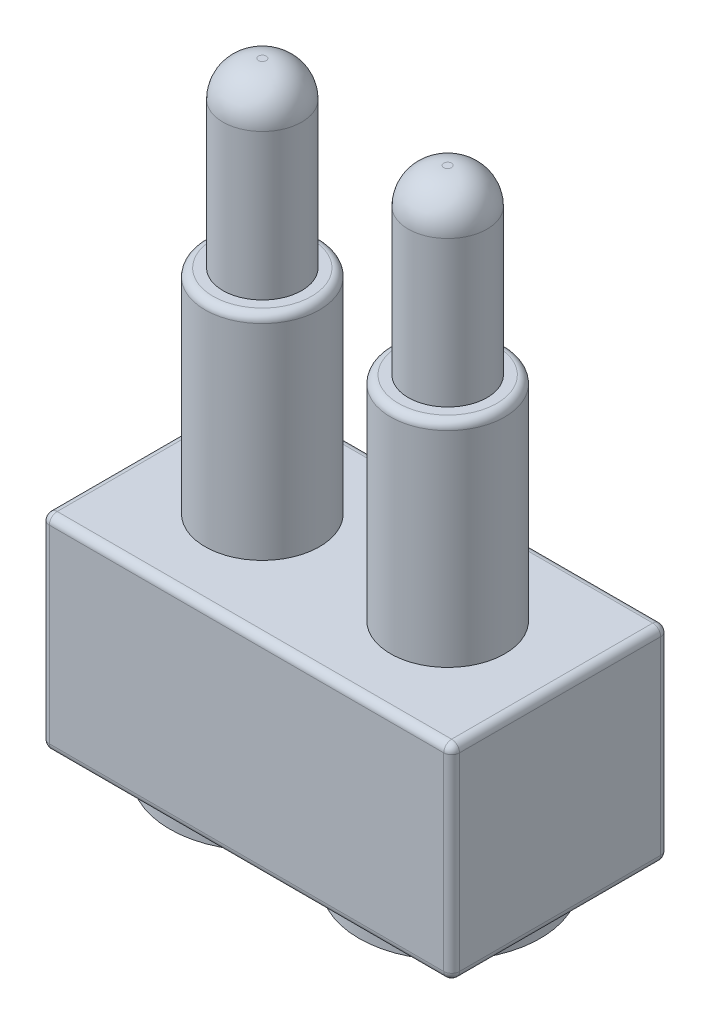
SolidWorks part; units mm, degrees
ref_plane "Спереди" through (0, 0, 0) normal (0, 0, 1) x (1, 0, 0)
ref_plane "Сверху" through (0, 0, 0) normal (0, 1, 0) x (1, 0, 0)
ref_plane "Справа" through (0, 0, 0) normal (1, 0, 0) x (0, 0, -1)
sketch "Эскиз1" plane through (0, 0, 0) normal (0, 1, 0) x (1, 0, 0)
  line L1 (-2.6, 1.375) -> (2.6, 1.375)
  line L2 (-2.6, 1.375) -> (-2.6, -1.375)
  line L3 (-2.6, -1.375) -> (2.6, -1.375)
  line L4 (2.6, 1.375) -> (2.6, -1.375)
  line L5 (-2.6, 1.375) -> (2.6, -1.375) construction
  line L6 (-2.6, -1.375) -> (2.6, 1.375) construction
  point P0 (0, 0)
  dimension "D1" = 2.75
  dimension "D2" = 5.2
extrude "Бобышка-Вытянуть1" add sketch "Эскиз1" along normal blind 2.6
sketch "Эскиз2" plane through (0, 0, 0) normal (0, -1, 0) x (1, 0, 0)
  line L0 (0, 1.375) -> (0, -1.375) construction
  line L1 (-2.6, 1.375) -> (2.6, 1.375) construction
  line L2 (2.6, -1.375) -> (-2.6, -1.375) construction
  line L3 (-2.6, 0) -> (2.6, 0) construction
  line L4 (-2.6, -1.375) -> (-2.6, 1.375) construction
  line L5 (2.6, 1.375) -> (2.6, -1.375) construction
  circle A0 centre (-1.2, 0) radius 1.15
  circle A1 centre (1.2, 0) radius 1.15
  point P14 (-1.1784, 0.2484)
  point P15 (0, 0)
  point P16 (-1.2995, 0)
  dimension "D1" = 2.3
  dimension "D2" = 4.7
extrude "Бобышка-Вытянуть2" add sketch "Эскиз2" along normal blind 0.3
sketch "Эскиз3" plane through (0, 2.6, 0) normal (0, 1, 0) x (1, 0, 0)
  line L0 (-2.6, 0) -> (2.6, 0) construction
  line L1 (-2.6, 1.375) -> (-2.6, -1.375) construction
  line L2 (2.6, -1.375) -> (2.6, 1.375) construction
  line L3 (0, 1.375) -> (0, 0) construction
  line L4 (2.6, 1.375) -> (-2.6, 1.375) construction
  circle A0 centre (-1.175, 0) radius 0.725
  circle A1 centre (1.175, 0) radius 0.725
  dimension "D1" = 1.45
  dimension "D2" = 3.8
extrude "Бобышка-Вытянуть3" add sketch "Эскиз3" along normal blind 2.7
sketch "Эскиз4" plane through (0, 5.3, 0) normal (0, 1, 0) x (1, 0, 0)
  circle A0 centre (-1.175, 0) radius 0.5
  circle A1 centre (1.175, 0) radius 0.5
  dimension "D1" = 1
extrude "Бобышка-Вытянуть4" add sketch "Эскиз4" along normal blind 2.3
fillet "Скругление1" radius 0.45 2 edges at (-1.175, 7.6, 0.5) (1.175, 7.6, 0.5)
fillet "Скругление2" radius 0.1 2 edges at (-1.175, 5.3, 0.725) (1.175, 5.3, -0.725)
fillet "Скругление3" radius 0.1 12 edges at (-2.6, 2.6, 0) (-2.6, 0, 0) (2.6, 2.6, 0) (2.6, 0, 0) (-2.6, 1.3, 1.375) (0, 2.6, 1.375) (2.6, 1.3, 1.375) (0, 0, 1.375) (2.6, 1.3, -1.375) (0, 2.6, -1.375) (-2.6, 1.3, -1.375) (0, 0, -1.375)
